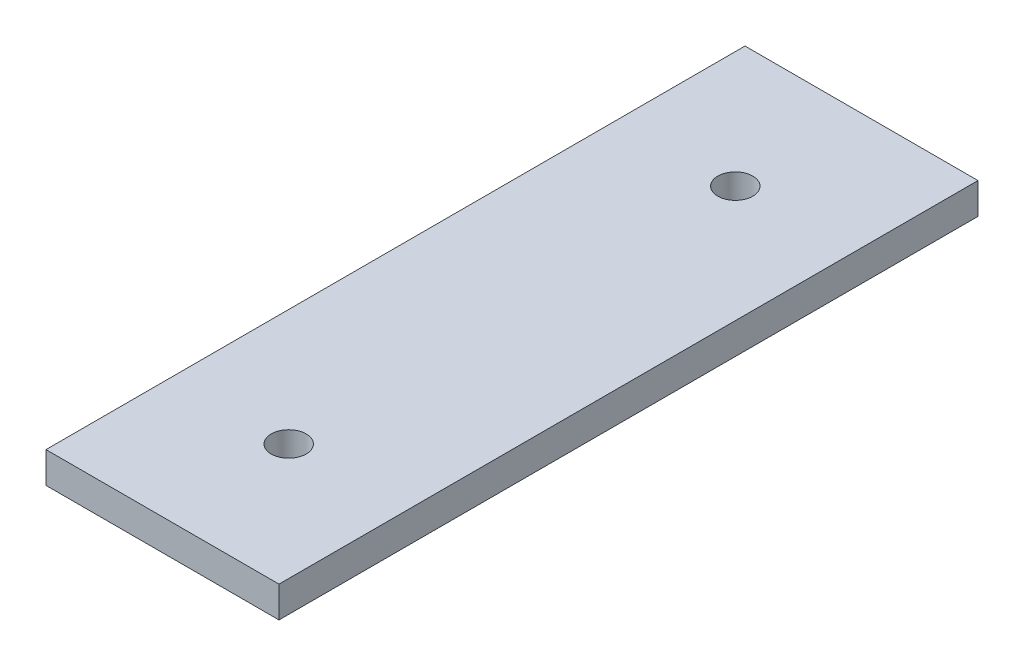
SolidWorks part; units mm, degrees
ref_plane "Face" through (0, 0, 0) normal (0, 0, 1) x (1, 0, 0)
ref_plane "Dessus" through (0, 0, 0) normal (0, 1, 0) x (1, 0, 0)
ref_plane "Droite" through (0, 0, 0) normal (1, 0, 0) x (0, 0, -1)
sketch "Esquisse1" plane through (0, 0, 0) normal (0, 0, 1) x (1, 0, 0)
  line L1 (0, 0) -> (60, 0)
  line L2 (0, 0) -> (0, -8)
  line L3 (0, -8) -> (60, -8)
  line L4 (60, 0) -> (60, -8)
  dimension "D1" = 60
  dimension "D2" = 8
extrude "Base-Extrusion" add sketch "Esquisse1" along normal blind 180
sketch "Esquisse2" plane through (0, 0, 0) normal (0, 1, 0) x (-1, 0, 0)
  line L0 (-60, 0) -> (0, 0) construction
  line L1 (-60, 180) -> (-60, 0) construction
  circle A0 centre (-30, 147.5) radius 4.5
  circle A1 centre (-30, 32.5) radius 4.5
  dimension "D2" = 9
  dimension "D1" = 115
  dimension "D3" = 32.5
  dimension "D4" = 30
extrude "Enlèv. mat.-Extru.1" cut sketch "Esquisse2" against normal blind 10
